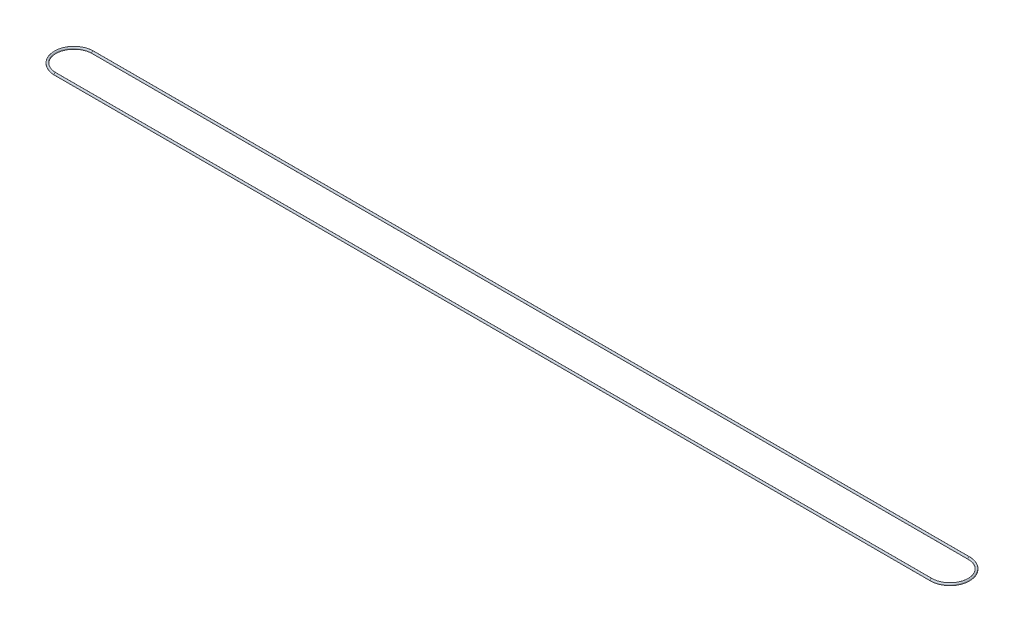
SolidWorks part; units mm, degrees
ref_plane "Front Plane" through (0, 0, 0) normal (0, 0, 1) x (1, 0, 0)
ref_plane "Top Plane" through (0, 0, 0) normal (0, 1, 0) x (1, 0, 0)
ref_plane "Right Plane" through (0, 0, 0) normal (1, 0, 0) x (0, 0, -1)
sketch "Sketch1" plane through (0, 0, 0) normal (0, 1, 0) x (1, 0, 0)
  line L0 (-1333.5, 57.15) -> (1333.5, 57.15)
  line L1 (1333.5, -57.15) -> (-1333.5, -57.15)
  arc A0 (-1333.5, 57.15) -> (-1333.5, -57.15) centre (-1333.5, 0) ccw
  arc A1 (1333.5, -57.15) -> (1333.5, 57.15) centre (1333.5, 0) ccw
  point P1 (0, -57.15)
  dimension "D2" = 57.15
  dimension "D1" = 2667
sketch "Sketch2" plane through (0, 0, 0) normal (1, 0, 0) x (0, 0, -1)
  line L0 (57.15, 0) -> (-57.15, 0) construction
  circle A0 centre (57.15, 0) radius 3.175
  dimension "D1" = 6.35
  dimension "D2" = 57.15
sweep "Sweep1" add profiles "Sketch2" path "Sketch1"
